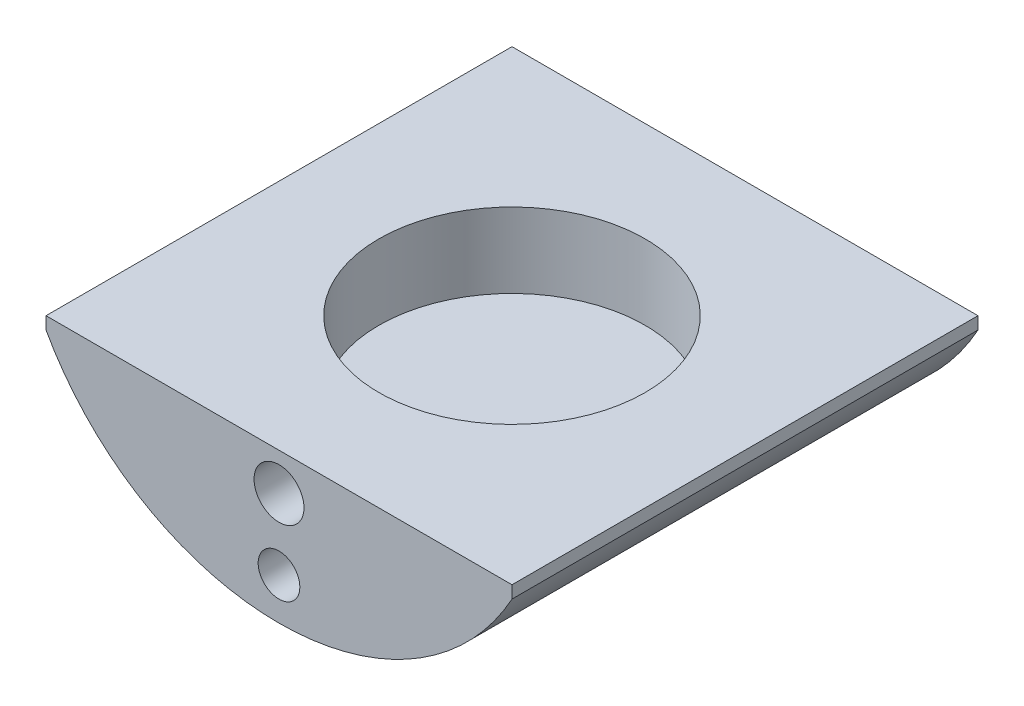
SolidWorks part; units mm, degrees
ref_plane "Front" through (0, 0, 0) normal (0, 0, 1) x (1, 0, 0)
ref_plane "Top" through (0, 0, 0) normal (0, 1, 0) x (1, 0, 0)
ref_plane "Right" through (0, 0, 0) normal (1, 0, 0) x (0, 0, -1)
sketch "Sketch1" plane through (0, 0, 0) normal (0, 0, 1) x (1, 0, 0)
  line L0 (-44.45, 0) -> (44.45, 0)
  line L1 (-44.45, 0) -> (-44.45, -2.3684)
  line L2 (50, 0) -> (-50, 0) construction
  line L3 (44.45, -2.3684) -> (44.45, 0)
  line L4 (0, 39.9875) -> (0, -57.418) construction
  line L5 (0, -50) -> (0, 50) construction
  arc A0 (-44.45, -2.3684) -> (44.45, -2.3684) centre (0, 22.225) ccw
  point P11 (0, 0)
  dimension "D3" = 50.8
  dimension "D1" = 28.575
  dimension "D2" = 88.9
extrude "Base-Extrude" add sketch "Sketch1" against normal mid plane 88.9
other "Hole1" parameters "D1"=14.2875
sketch "Sketch2" plane through (0, 0, 0) normal (0, 1, 0) x (-1, 0, 0)
  circle A0 centre (0, 0) radius 25.4
  dimension "D1" = 50.8
other "Hole2" parameters "D1"=14.2875
sketch "Sketch4" plane through (0, 0, 44.45) normal (0, 0, 1) x (1, 0, 0)
  line L0 (-44.45, 0) -> (44.45, 0) construction
  line L1 (0, -50) -> (0, 50) construction
  circle A0 centre (0, -7.1438) radius 4.7625
  dimension "D1" = 9.525
  dimension "D2" = 7.1437
sketch "Sketch5" plane through (-3.0654, -13.7769, 44.45) normal (0, 0, 1) x (1, 0, 0)
  line L0 (3.0654, -36.2231) -> (3.0654, 63.7769) construction
  line L1 (-41.3846, 13.7769) -> (47.5154, 13.7769) construction
  circle A0 centre (3.0654, -6.8479) radius 3.9751
  dimension "D1" = 7.9502
  dimension "D2" = 20.6248
other "Hole3" parameters "D1"=17.4625
mirror "Mirror1" about plane through (0, 0, 0) normal (0, 0, 1) of "Hole3", "Hole2"
